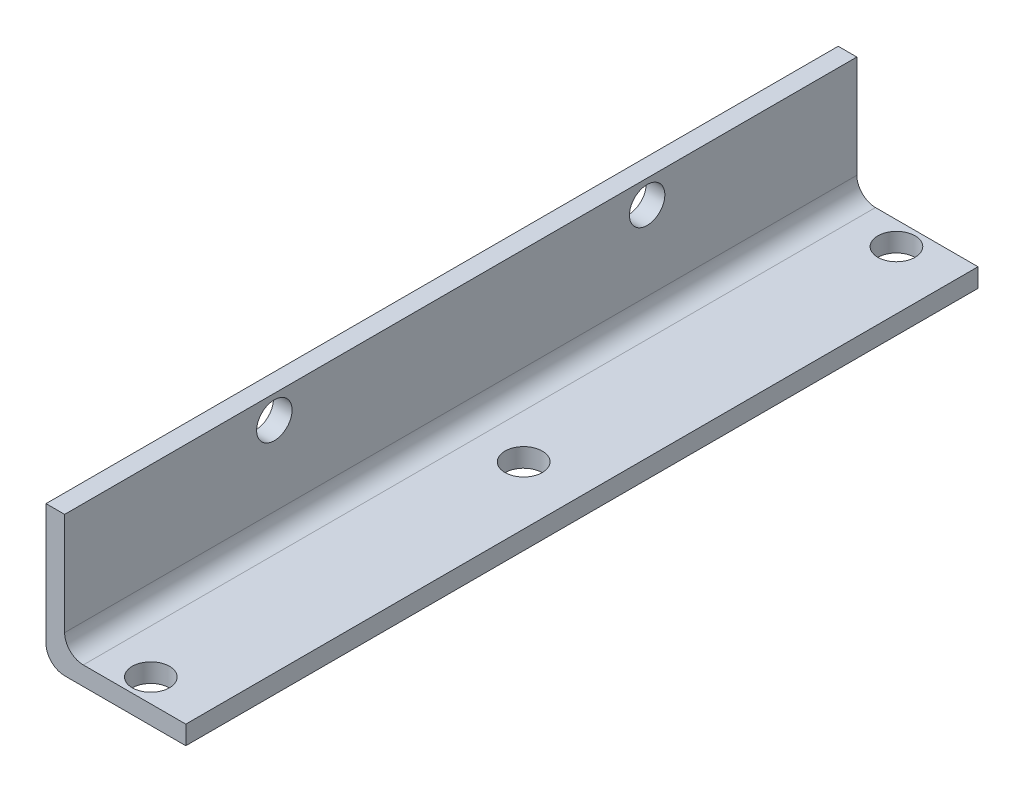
SolidWorks part; units mm, degrees
ref_plane "Front Plane" through (0, 0, 0) normal (0, 0, 1) x (1, 0, 0)
ref_plane "Top Plane" through (0, 0, 0) normal (0, 1, 0) x (1, 0, 0)
ref_plane "Right Plane" through (0, 0, 0) normal (1, 0, 0) x (0, 0, -1)
sketch "Sketch1" plane through (0, 0, 0) normal (0, 0, 1) x (1, 0, 0)
  line L0 (0, 38.1) -> (0, 5.08)
  line L1 (5.08, 0) -> (38.1, 0)
  line L2 (38.1, 0) -> (38.1, 5.1086)
  line L3 (38.1, 5.1086) -> (10.16, 5.1086)
  line L4 (5.08, 10.1886) -> (5.08, 38.1)
  line L5 (5.08, 38.1) -> (0, 38.1)
  arc A0 (10.16, 5.1086) -> (5.08, 10.1886) centre (10.16, 10.1886) cw
  arc A1 (5.08, 0) -> (0, 5.08) centre (5.08, 5.08) cw
  point P11 (0, 0)
  dimension "D5" = 5.08
  dimension "D6" = 5.08
  dimension "D1" = 38.1
  dimension "D2" = 38.1
  dimension "D3" = 5.1086
  dimension "D4" = 5.08
extrude "Extrude1" add sketch "Sketch1" along normal mid plane 215.9
sketch "Sketch2" plane through (5.08, 0, 0) normal (1, 0, 0) x (0, 0, -1)
  line L0 (-107.95, 0) -> (107.95, 0) construction
  circle A0 centre (-50.8, 31.75) radius 4.826
  dimension "D1" = 9.652
  dimension "D2" = 31.75
  dimension "D3" = 50.8
extrude "Cut-Extrude1" cut sketch "Sketch2" against normal through all
mirror "Mirror1" about plane through (0, 0, 0) normal (0, 0, 1) of "Cut-Extrude1"
sketch "Sketch3" plane through (0, 5.1086, 0) normal (0, 1, 0) x (-1, 0, 0)
  circle A0 centre (-22.225, 0) radius 5.08
  dimension "D3" = 10.16
  dimension "D2" = 22.225
extrude "Cut-Extrude2" cut sketch "Sketch3" against normal through all
pattern_linear "LPattern1" count 2 spacing 101.6 along (0, 0, -1) of "Cut-Extrude2"
pattern_linear "LPattern2" count 2 spacing 101.6 along (0, 0, 1) of "Cut-Extrude2"
